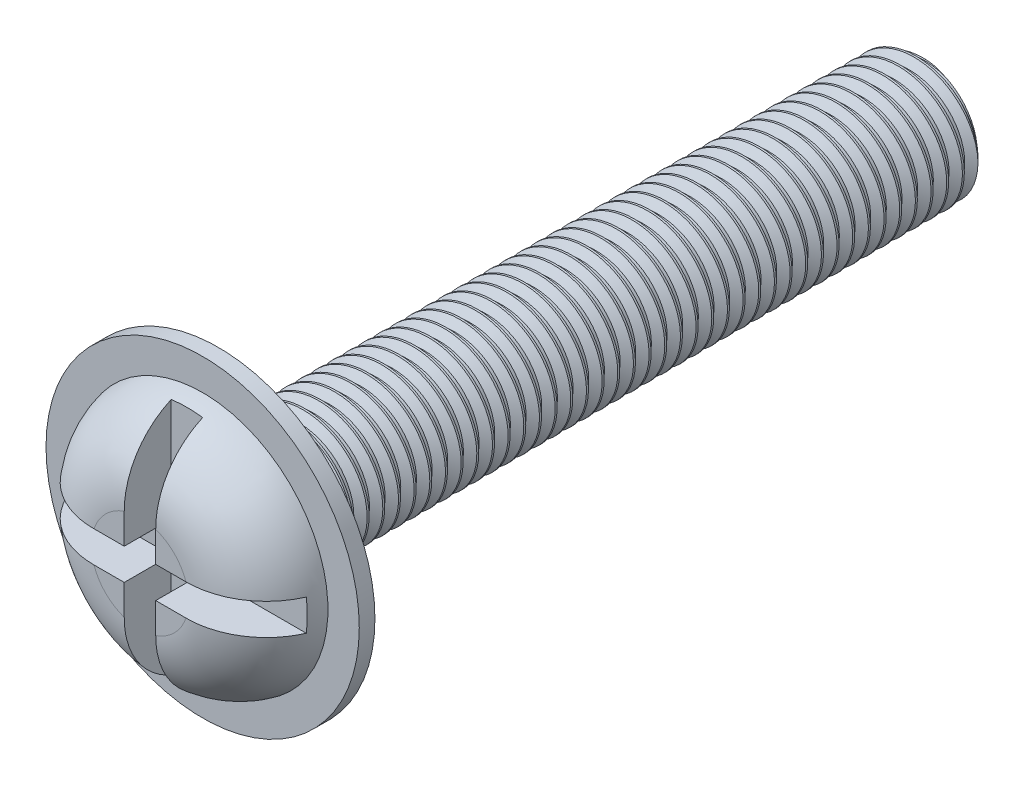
SolidWorks part; units mm, degrees
ref_plane "Плоскость1" through (0, 0, 0) normal (0, 0, 1) x (1, 0, 0)
ref_plane "Плоскость2" through (0, 0, 0) normal (0, 1, 0) x (1, 0, 0)
ref_plane "Плоскость3" through (0, 0, 0) normal (1, 0, 0) x (0, 0, -1)
sketch "Эскиз1" plane through (0, 0, 0) normal (0, 0, 1) x (1, 0, 0)
  circle A0 centre (0, 0) radius 4
  dimension "D1" = 8
extrude "Основание-Вытянуть" add sketch "Эскиз1" along normal blind 46
sketch "Эскиз2" plane through (0, 0, 46) normal (0, 0, 1) x (1, 0, 0)
  circle A0 centre (0, 0) radius 8
  dimension "D1" = 16
extrude "Бобышка-Вытянуть1" add sketch "Эскиз2" along normal blind 4
fillet "Скругление1" radius 5 1 edges at (8, 0, 50)
chamfer "Фаска1" distance 0.5 angle 45 1 edges at (4, 0, 0)
sketch "Эскиз3" plane through (0, 0, 50) normal (0, 0, 1) x (1, 0, 0)
  line L0 (0, 0) -> (0, 44.3713) construction
  line L1 (1.0048, 1) -> (10.0296, 1)
  line L2 (-10.0296, 1) -> (-1.0048, 1)
  line L3 (-10.0296, -1) -> (-1.0048, -1)
  line L4 (10.0296, 1) -> (10.0296, -1)
  line L5 (-10.0296, 1) -> (-10.0296, -1)
  line L6 (-1.0048, 10.0249) -> (1.0048, 10.0249)
  line L7 (-1.0048, 10.0249) -> (-1.0048, 1)
  line L8 (-1.0048, -10.0249) -> (1.0048, -10.0249)
  line L9 (1.0048, 10.0249) -> (1.0048, 1)
  line L10 (1.0048, -1) -> (1.0048, -10.0249)
  line L11 (-1.0048, -1) -> (-1.0048, -10.0249)
  line L12 (1.0048, -1) -> (10.0296, -1)
  line L13 (0, -10.0249) -> (0, 10.0249) construction
  line L14 (10.0296, 0) -> (-10.0296, 0) construction
extrude "Вырез-Вытянуть1" cut sketch "Эскиз3" against normal blind 3
sketch "Эскиз4" plane through (0, 0, 46) normal (0, 0, -1) x (-1, 0, 0)
  circle A0 centre (0, 0) radius 10
  dimension "D1" = 20
extrude "Бобышка-Вытянуть2" add sketch "Эскиз4" along normal blind 1
thread "Резьба1" pitch 1 start angle 0, offset 1, length 45, pitch 1, diameter 8
ref_plane "Плоскость4" through (4, 0, -0.5) normal (0, -1, 0) x (1, 0, 0)
sketch "Профиль резьбы1" plane through (4, 0, -0.5) normal (0, -1, 0) x (1, 0, 0)
  line L0 (0, 0) -> (0, 1) construction
  line L11 (0, 0) -> (0, 0.875)
  line L12 (0, 0.875) -> (-0.5413, 0.5625)
  line L13 (-0.5413, 0.5625) -> (-0.5413, 0.3125)
  line L15 (-0.5413, 0.3125) -> (0, 0)
  line L17 (-0.5413, 0.4375) -> (0, 0.4375) construction
  point P2 (0, 0)
  dimension "Pitch" = 1
  dimension "Profile_Angle" = 60
  dimension "Profile_Land" = 0.25
  dimension "Profile_Height" = 0.5413
